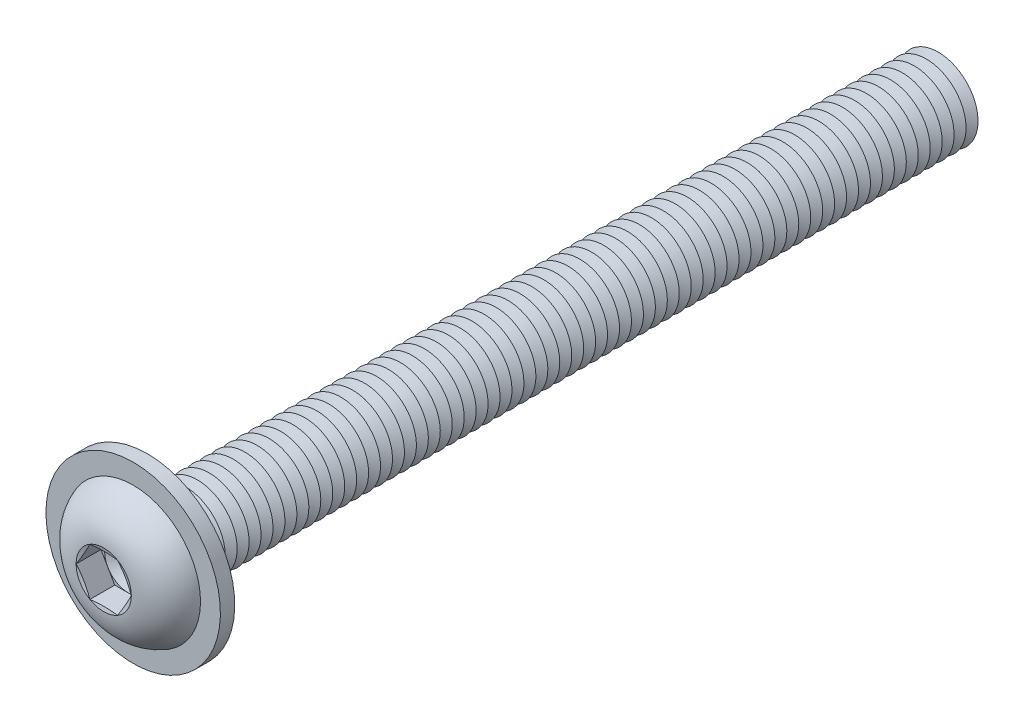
SolidWorks part; units mm, degrees
ref_plane "Front Plane" through (0, 0, 0) normal (0, 0, 1) x (1, 0, 0)
ref_plane "Top Plane" through (0, 0, 0) normal (0, 1, 0) x (1, 0, 0)
ref_plane "Right Plane" through (0, 0, 0) normal (1, 0, 0) x (0, 0, -1)
sketch "Sketch1" plane through (0, 0, 0) normal (1, 0, 0) x (0, 0, -1)
  line L0 (0, 5) -> (0, 8.75)
  line L3 (0, 5) -> (100, 5)
  line L4 (100, 5) -> (100, 0)
  line L5 (100, 0) -> (-5.5, 0) construction
  line L6 (-5.5, 0) -> (100, 0)
  line L7 (-5.5, 3.4641) -> (-5.5, 1.732) construction
  line L8 (-5.5, 1.732) -> (-5.5, 0)
  line L9 (-5.5, 3.4641) -> (-5.0359, 1.732)
  line L10 (-5.0359, 1.732) -> (-5.5, 1.732)
  line L11 (100, 0) -> (22.7481, 0) construction
  line L12 (0, 8.75) -> (-5.5, 8.75) construction
  arc A1 (0, 8.75) -> (-5.5, 3.4641) centre (0, 3.2457) ccw
  point P8 (100, 2.5)
  dimension "D1" = 17.5
  dimension "D2" = 10
  dimension "D3" = 5.5
  dimension "D4" = 6.9282
  dimension "D5" = 100
  dimension "D6" = 15
revolve "Revolve1" add sketch "Sketch1" angle 360 about L5
fillet "Fillet1" radius 0.75 1 edges at (0, 5, 0)
sketch "Sketch2" plane through (0, 0, 0) normal (1, 0, 0) x (0, 0, -1)
  line L0 (99.25, 5) -> (100.75, 5)
  line L1 (100, 5) -> (0.75, 5) construction
  line L2 (100.75, 5) -> (100, 3.701)
  line L3 (100, -5) -> (100, 5) construction
  line L4 (100, 3.701) -> (99.25, 5)
  dimension "D1" = 1.5
revolve "Cut-Revolve1" cut sketch "Sketch2" angle 360 about axis through (0, 0, -100) along (0, 0, -1)
pattern_linear "LPattern1" count 66 spacing 1.5 along (0, 0, 1) of "Cut-Revolve1"
sketch "Sketch3" plane through (0, 0, 5.5) normal (0, 0, 1) x (1, 0, 0)
  line L7 (1.732, 3) -> (-1.7321, 3)
  line L8 (-1.7321, 3) -> (-3.4641, 0)
  line L9 (-3.4641, 0) -> (-1.732, -3)
  line L10 (-1.732, -3) -> (1.732, -3)
  line L11 (1.732, -3) -> (3.4641, 0)
  line L12 (3.4641, 0) -> (1.732, 3)
  circle A0 centre (0, 0) radius 3 construction
  circle A3 centre (0, 0) radius 3.4641 construction
extrude "Cut-Extrude1" cut sketch "Sketch3" against normal blind 3.12
sketch "Sketch4" plane through (0, 0, 2.38) normal (0, 0, 1) x (1, 0, 0)
  line L1 (1.732, 3) -> (-1.7321, 3) construction
  circle A0 centre (0, 0) radius 3
extrude "Cut-Extrude2" cut sketch "Sketch4" against normal through all draft 60
sketch "Sketch5" plane through (0, 0, 0) normal (0, 0, -1) x (-1, 0, 0)
  circle A0 centre (0, 0) radius 10.95
  circle A1 centre (0, 0) radius 5.75
  circle A2 centre (0, 0) radius 5.75 construction
  dimension "D1" = 21.9
extrude "Boss-Extrude1" add sketch "Sketch5" against normal blind 1.8
